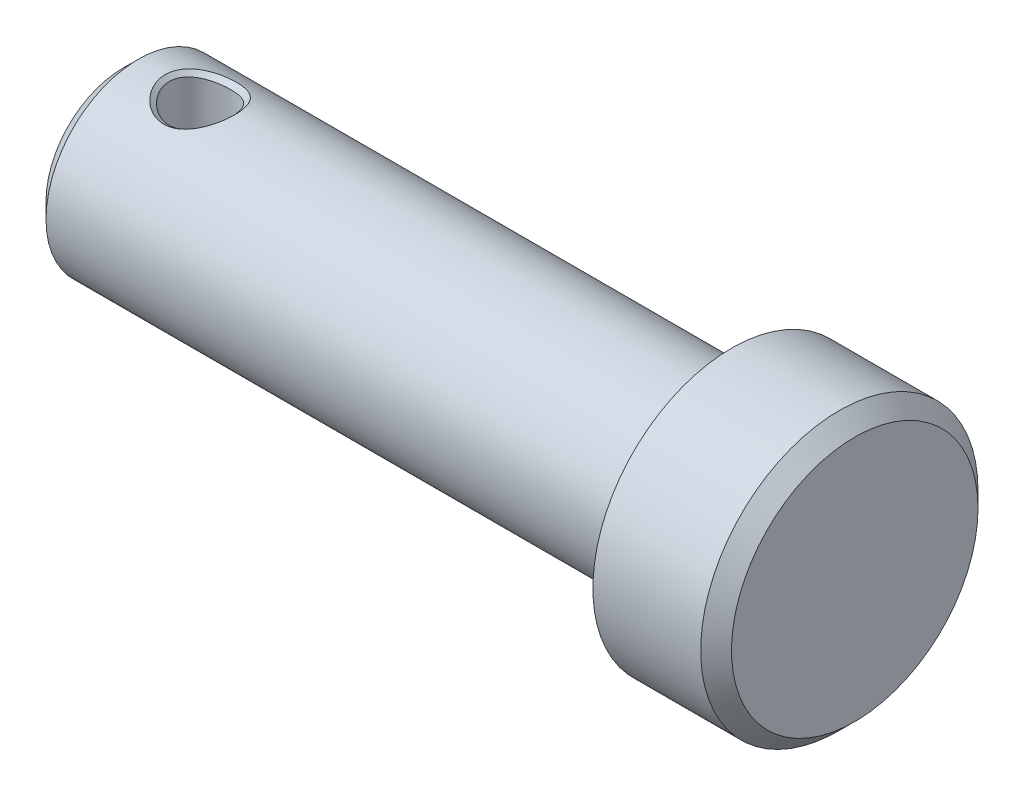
SolidWorks part; units mm, degrees
ref_plane "Plan de face" through (0, 0, 0) normal (0, 0, 1) x (1, 0, 0)
ref_plane "Plan de dessus" through (0, 0, 0) normal (0, 1, 0) x (1, 0, 0)
ref_plane "Plan de droite" through (0, 0, 0) normal (1, 0, 0) x (0, 0, -1)
sketch "Esquisse1" plane through (0, 0, 0) normal (0, 0, 1) x (1, 0, 0)
  line L0 (0, 9) -> (0, 0)
  line L1 (0, 0) -> (8, 0)
  line L2 (8, 0) -> (8, 9)
  line L3 (8, 9) -> (0, 9)
  line L4 (0, 0) -> (8, 0) construction
revolve "Révolution1" add sketch "Esquisse1" angle 360 about L4
sketch "Esquisse2" plane through (0, 0, 0) normal (-1, 0, 0) x (0, 0, 1)
  circle A0 centre (0, 0) radius 6
extrude "Boss.-Extru.1" add sketch "Esquisse2" along normal blind 39.5
hole_wizard "Diamètre du perçage Ø4.0 (4)1" positions "Esquisse3D1" profile "Esquisse3" hole size "Ø4.0" standard "Ansi Metric"
sketch3d "Esquisse3D1"
  point P0 (-34.5, -6, 0)
sketch "Esquisse3" plane through (-34.5, -6, 0) normal (1, 0, 0) x (0, 0, -1)
  line L0 (0, 0) -> (0, 15)
  line L1 (0, 15) -> (2, 15)
  line L2 (2, 15) -> (2, 0)
  line L5 (2, 0) -> (0, 0)
  line L11 (0, -6.35) -> (0, 107.95) construction
  dimension "Diamètre du perçage jusqu'au prochain" = 4
  dimension "Profondeur du perçage jusqu'au prochain" = 15
chamfer "Chanfrein1" distance 1 angle 45 2 edges at (-39.5, 0, 6) (8, 0, -9)
chamfer "Chanfrein2" distance 0.378 angle 56.518 2 edges at (-34.8418, 5.6672, 1.9706) (-34.1582, -5.6672, 1.9706)
